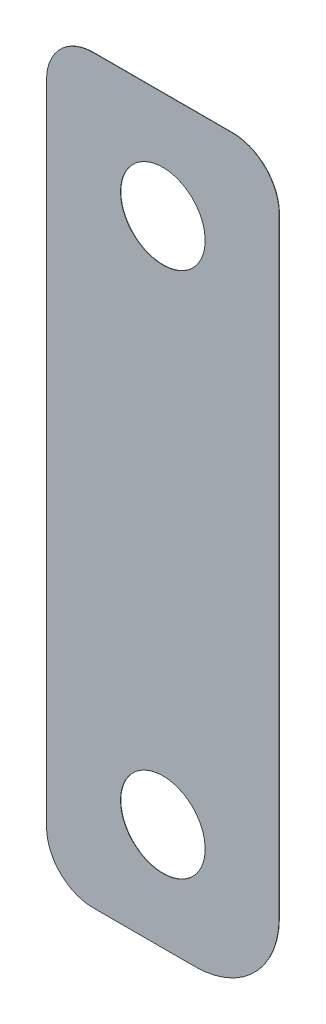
SolidWorks part; units mm, degrees
ref_plane "Front" through (0, 0, 0) normal (0, 0, 1) x (1, 0, 0)
ref_plane "Top" through (0, 0, 0) normal (0, 1, 0) x (1, 0, 0)
ref_plane "Right" through (0, 0, 0) normal (1, 0, 0) x (0, 0, -1)
ref_plane "Plane1"
sketch "Sketch1" plane through (0, 0, 71.9328) normal (0, 0, -1) x (-1, 0, 0)
  line L4 (925.9565, 0.7996) -> (914.209, 0.7996)
  line L5 (930.4015, -58.2554) -> (930.4015, -3.6454)
  line L6 (917.384, -62.7004) -> (925.9565, -62.7004)
  line L7 (909.764, -3.6454) -> (909.764, -55.0804)
  line L8 (925.9565, 0.7996) -> (914.209, 0.7996)
  line L9 (930.4015, -58.2554) -> (930.4015, -3.6454)
  line L10 (917.384, -62.7004) -> (925.9565, -62.7004)
  line L11 (909.764, -3.6454) -> (909.764, -55.0804)
  arc A4 (930.4015, -3.6454) -> (925.9565, 0.7996) centre (925.9565, -3.6454) ccw
  arc A5 (925.9565, -62.7004) -> (930.4015, -58.2554) centre (925.9565, -58.2554) ccw
  arc A6 (909.764, -55.0804) -> (917.384, -62.7004) centre (917.384, -55.0804) ccw
  arc A7 (914.209, 0.7996) -> (909.764, -3.6454) centre (914.209, -3.6454) ccw
  arc A8 (930.4015, -3.6454) -> (925.9565, 0.7996) centre (925.9565, -3.6454) ccw
  arc A9 (925.9565, -62.7004) -> (930.4015, -58.2554) centre (925.9565, -58.2554) ccw
  arc A10 (909.764, -55.0804) -> (917.384, -62.7004) centre (917.384, -55.0804) ccw
  arc A11 (914.209, 0.7996) -> (909.764, -3.6454) centre (914.209, -3.6454) ccw
sketch "Sketch2" plane through (0, 0, 71.9328) normal (0, 0, -1) x (-1, 0, 0)
  line L4 (925.9565, 0.2916) -> (914.209, 0.2916)
  line L5 (910.272, -3.6454) -> (910.272, -55.0804)
  line L6 (917.384, -62.1924) -> (925.9565, -62.1924)
  line L7 (929.8935, -58.2554) -> (929.8935, -3.6454)
  line L8 (925.9565, 0.2916) -> (914.209, 0.2916)
  line L9 (910.272, -3.6454) -> (910.272, -55.0804)
  line L10 (917.384, -62.1924) -> (925.9565, -62.1924)
  line L11 (929.8935, -58.2554) -> (929.8935, -3.6454)
  arc A4 (914.209, 0.2916) -> (910.272, -3.6454) centre (914.209, -3.6454) ccw
  arc A5 (910.272, -55.0804) -> (917.384, -62.1924) centre (917.384, -55.0804) ccw
  arc A6 (925.9565, -62.1924) -> (929.8935, -58.2554) centre (925.9565, -58.2554) ccw
  arc A7 (929.8935, -3.6454) -> (925.9565, 0.2916) centre (925.9565, -3.6454) ccw
  arc A8 (914.209, 0.2916) -> (910.272, -3.6454) centre (914.209, -3.6454) ccw
  arc A9 (910.272, -55.0804) -> (917.384, -62.1924) centre (917.384, -55.0804) ccw
  arc A10 (925.9565, -62.1924) -> (929.8935, -58.2554) centre (925.9565, -58.2554) ccw
  arc A11 (929.8935, -3.6454) -> (925.9565, 0.2916) centre (925.9565, -3.6454) ccw
extrude "Boss-Extrude1" add sketch "Sketch2" against normal blind 0.0254 flip side to cut
hole_wizard "Hole1" positions "Point_Sketch" profile "Profil_Sketch" hole size "Ø0.15" standard "ISO"
sketch "Point_Sketch" plane through (-916.4285, 1.8757, 71.9328) normal (0, 0, 1) x (-1, 0, 0)
  point P0 (3.6543, 10.6011)
  point P2 (3.6543, 55.0511)
sketch "Profil_Sketch" plane through (-920.0828, -8.7254, 71.9328) normal (1, 0, 0) x (0, 1, 0)
  line L0 (0, 0) -> (0, 0.0254)
  line L1 (0, 0.0254) -> (3.5687, 0.0254)
  line L2 (3.5687, 0.0254) -> (3.5687, 0)
  line L5 (3.5687, 0) -> (0, 0)
  line L11 (0, -6.35) -> (0, 107.95) construction
  dimension "Diameter" = 7.1374
  dimension "Thru Hole Depth" = 0.0254
other "usin_DL090_.25-20x1.75-SHCS<1>"
